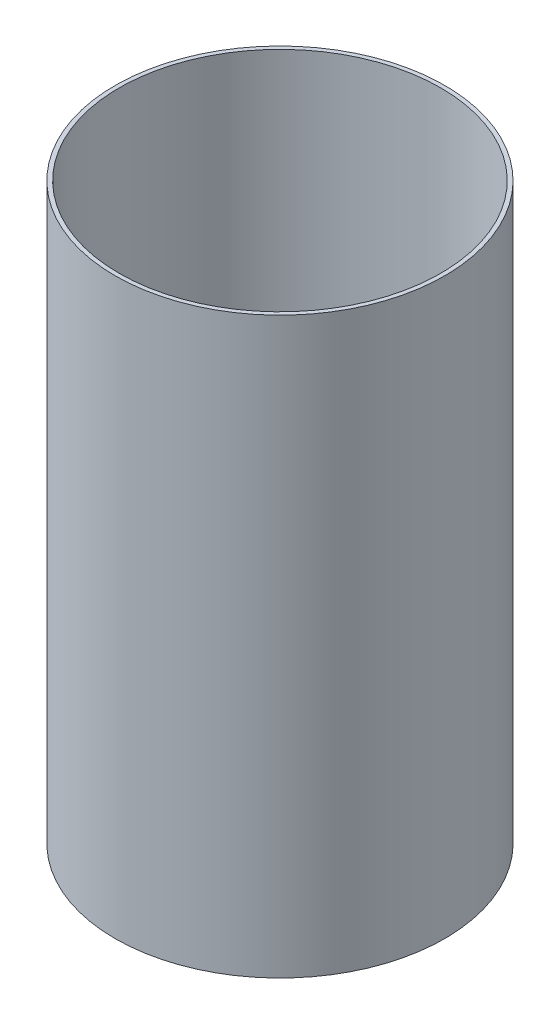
SolidWorks part; units mm, degrees
ref_plane "Front Plane" through (0, 0, 0) normal (0, 0, 1) x (1, 0, 0)
ref_plane "Top Plane" through (0, 0, 0) normal (0, 1, 0) x (1, 0, 0)
ref_plane "Right Plane" through (0, 0, 0) normal (1, 0, 0) x (0, 0, -1)
sketch "Sketch1" plane through (0, 0, 0) normal (0, 1, 0) x (1, 0, 0)
  circle A0 centre (0, 0) radius 10.05
  circle A1 centre (0, 0) radius 9.8
  dimension "D1" = 20.1
  dimension "D2" = 0.25
extrude "Boss-Extrude1" add sketch "Sketch1" along normal mid plane 35
